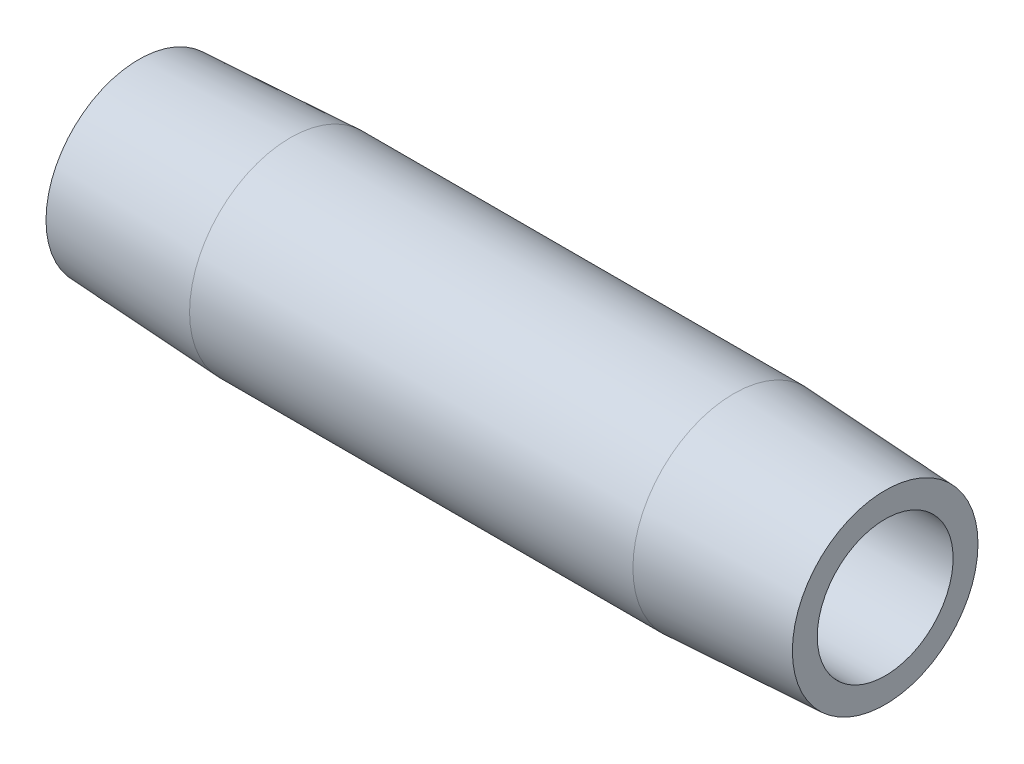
SolidWorks part; units mm, degrees
ref_plane "Front Plane" through (0, 0, 0) normal (0, 0, 1) x (1, 0, 0)
ref_plane "Top Plane" through (0, 0, 0) normal (0, 1, 0) x (1, 0, 0)
ref_plane "Right Plane" through (0, 0, 0) normal (1, 0, 0) x (0, 0, -1)
sketch "Sketch1" plane through (0, 0, 0) normal (0, 1, 0) x (1, 0, 0)
  line L6 (50.8, 4.6228) -> (0, 4.6228)
  line L7 (10.3124, 6.858) -> (0, 6.3175)
  line L8 (0, 6.3175) -> (0, 4.6228)
  line L9 (40.4876, 6.858) -> (10.3124, 6.858)
  line L10 (50.8, 6.3175) -> (40.4876, 6.858)
  line L11 (50.8, 4.6228) -> (50.8, 6.3175)
  line L12 (-6.376, 0) -> (49993.624, 0) construction
  dimension "D1" = 9.2456
  dimension "D2" = 13.716
  dimension "D3" = 3
  dimension "D4" = 3
  dimension "D5" = 50.8
  dimension "D6" = 10.3124
  dimension "D7" = 10.3124
revolve "Revolve1" add sketch "Sketch1" angle 360 about L12
